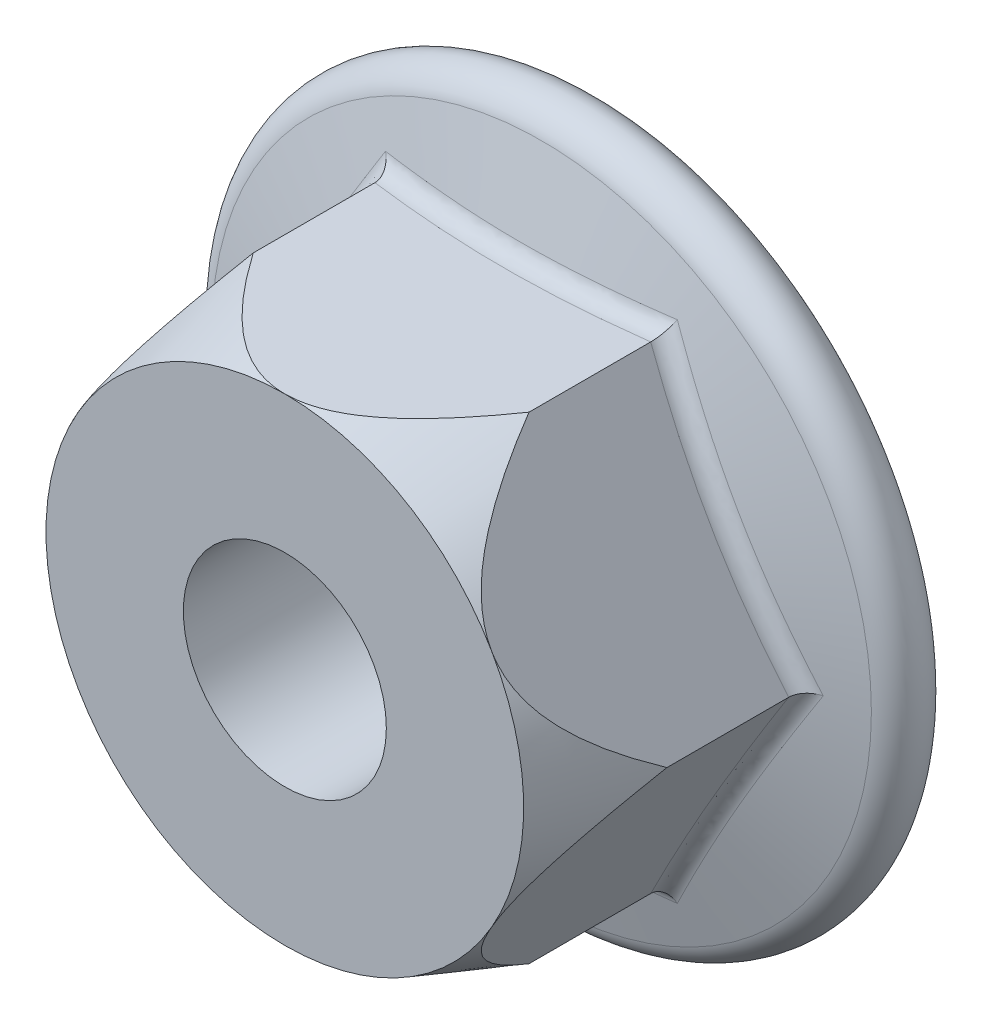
SolidWorks part; units mm, degrees
ref_plane "Front" through (0, 0, 0) normal (0, 0, 1) x (1, 0, 0)
ref_plane "Top" through (0, 0, 0) normal (0, 1, 0) x (1, 0, 0)
ref_plane "Right" through (0, 0, 0) normal (1, 0, 0) x (0, 0, -1)
sketch "Sketch1" plane through (0, 0, 0) normal (0, 0, 1) x (1, 0, 0)
  line L1 (4.6188, 0) -> (2.3094, 4)
  line L2 (2.3094, 4) -> (-2.3094, 4)
  line L3 (-2.3094, 4) -> (-4.6188, 0)
  line L4 (-4.6188, 0) -> (-2.3094, -4)
  line L5 (-2.3094, -4) -> (2.3094, -4)
  line L6 (2.3094, -4) -> (4.6188, 0)
  circle A0 centre (0, 0) radius 4 construction
  dimension "s" = 8
extrude "BaseNut" add sketch "Sketch1" against normal blind 5.3
sketch "Sketch2" plane through (-0.4812, 0, -5.1) normal (0, 1, 0) x (0, 0, -1)
  line L0 (-0.1158, 4.1376) -> (0.2, 4.1376)
  line L2 (0.2, 4.1376) -> (0.2, 2.9588)
  line L4 (0.2, 2.9588) -> (-0.1158, 4.1376)
  line L5 (-3.32, 4.1376) -> (-5.1, 4.1376)
  line L6 (-5.1, 4.1376) -> (-5.1, 3.5188)
  line L8 (-5.1, 3.5188) -> (-3.32, 4.1376)
  line L9 (0, -0.4812) -> (-5.5811, -0.4812) construction
  line L10 (-5.1, 1.8282) -> (-5.1, 4.1376) construction
  line L11 (0.2, 4.1376) -> (-5.1, 4.1376) construction
  line L12 (0.2, 4.1376) -> (0.2, 1.8282) construction
  dimension "e" = 8
  dimension "D" = 6.88
  dimension "m" = 3.52
  dimension "D4" = 15
revolve "Double-Chamfer" cut sketch "Sketch2" angle 360 about L9
sketch "Sketch3" plane through (0, 0, 0) normal (0, 0, 1) x (1, 0, 0)
  circle A0 centre (0, 0) radius 1.7
  dimension "D1" = 3.4
extrude "Hole" cut sketch "Sketch3" against normal through all
chamfer "EndChamfer" distance 0.4857 angle 45 1 edges at (1.7, 0, -5.3)
sketch "Sketch4" plane through (0.0678, 0, -5.8322) normal (0, 1, 0) x (0, 0, -1)
  line L0 (-0.5322, 3.5078) -> (-0.5322, 5.4592)
  line L1 (-0.7835, 5.5908) -> (-1.5322, 5.5908) construction
  line L2 (-1.5322, 5.5908) -> (-1.7744, 4.6866)
  line L3 (-0.5322, 4.6866) -> (-0.5322, 3.5078) construction
  line L4 (-1.7744, 4.6866) -> (-1.7744, 3.5078) construction
  line L5 (-1.7744, 3.5078) -> (-0.5322, 3.5078)
  line L6 (-0.7835, 0.0678) -> (-6.5479, 0.0678) construction
  line L8 (-1.7744, 3.5078) -> (-2.0903, 3.5078)
  line L9 (-1.7744, 4.6866) -> (-2.0903, 3.5078)
  line L12 (-0.848, 4.6866) -> (-4.0522, 4.6866) construction
  arc A0 (-0.5322, 5.4592) -> (-1.5322, 5.5908) centre (-1.0408, 5.4592) ccw
  dimension "D1" = 11.8
  dimension "h1" = 1
  dimension "D2" = 15
revolve "Flange" add sketch "Sketch4" angle 360 about L6
fillet "FlangeFillet" radius 0.3 6 edges
sketch "Sketch5" plane through (0, 0, 0) normal (0, 1, 0) x (1, 0, 0)
  line L0 (0, 6.0366) -> (0, -0.8862) construction
  line L1 (1.4, 4.9643) -> (1.7, 4.9643)
  line L2 (1.7, 4.9643) -> (1.9598, 4.8143)
  line L3 (1.9598, 4.8143) -> (1.7, 4.6643)
  line L4 (1.7, 4.6643) -> (1.4, 4.6643)
  line L5 (1.4, 4.6643) -> (1.4, 4.9643)
  line L6 (1.7, 4.8143) -> (-1.7, 4.8143) construction
  dimension "D1" = 0.3
  dimension "D2" = 3.4
revolve "Cut-Revolve10" [suppressed] cut sketch "Sketch5" angle 360 about L0
pattern_linear "LPattern10" [suppressed] count 13 spacing 0.36
equation "\"e@Sketch2\" = \"s@Sketch1\""
equation "\"D1@EndChamfer\" = \"D1@Sketch3\" / 7"
equation "\"D2@Sketch5\" = \"D1@Sketch3\""
equation "\"D1@Sketch5\" = (  \"D2@ThreadCosmetic1\" - \"D1@Sketch3\" )  / 2"
equation "\"D3@LPattern10\" = \"D1@Sketch5\" * 1.2"
equation "\"D1@LPattern10\" = (  \"h@BaseNut\"  - \"D1@EndChamfer\" ) / \"D3@LPattern10\" "
